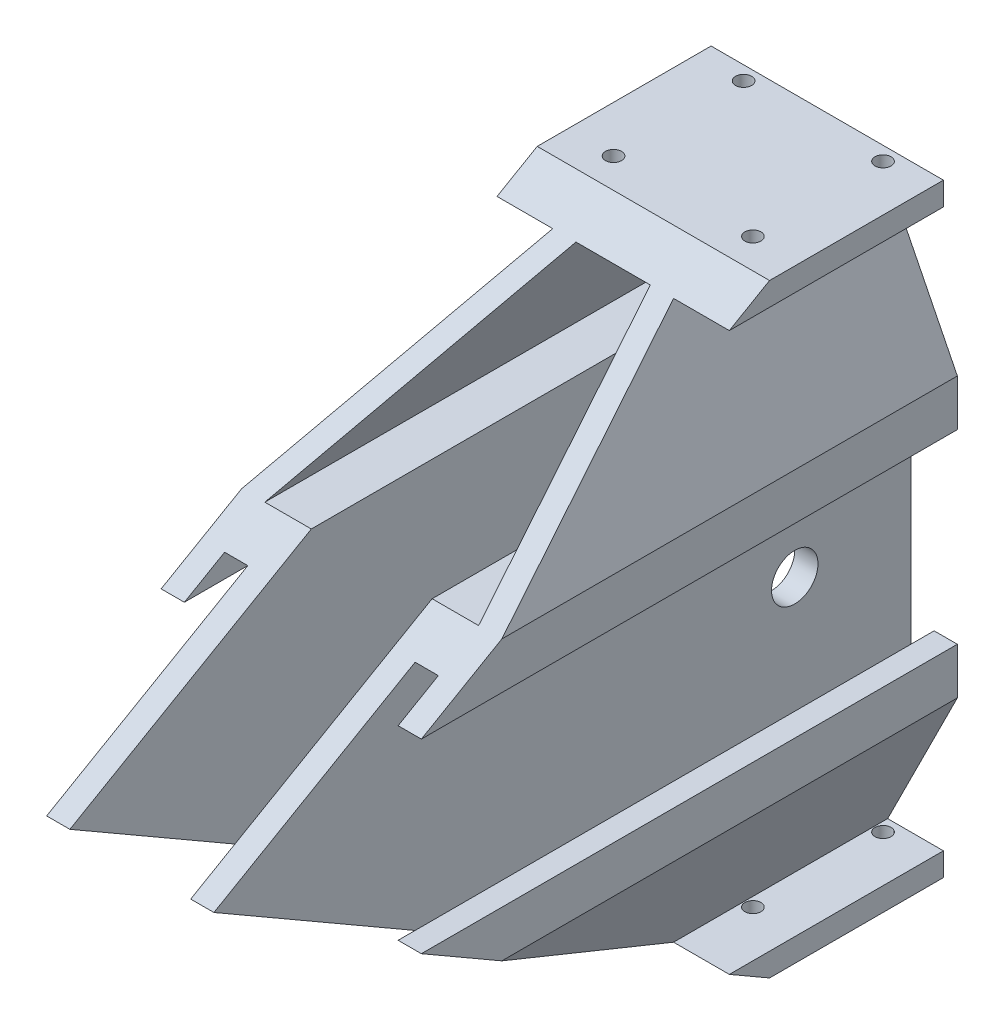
SolidWorks part; units mm, degrees
ref_plane "Front Plane" through (0, 0, 0) normal (0, 0, 1) x (1, 0, 0)
ref_plane "Top Plane" through (0, 0, 0) normal (0, 1, 0) x (1, 0, 0)
ref_plane "Right Plane" through (0, 0, 0) normal (1, 0, 0) x (0, 0, -1)
sketch "Sketch1" plane through (0, 0, 0) normal (0, 0, 1) x (1, 0, 0)
  line L0 (-18, 25) -> (-23, 25)
  line L1 (-18, 0) -> (18, 0) construction
  line L2 (-18, 25) -> (-18, -25)
  line L3 (-18, 25) -> (18, 25) construction
  line L4 (18, 25) -> (18, -25)
  line L5 (-18, 0) -> (18, 25) construction
  line L6 (-18, 25) -> (18, 0) construction
  line L7 (-23, 25) -> (-23, 20)
  line L8 (-23, 20) -> (-28, 20)
  line L9 (-28, 20) -> (-28, 30)
  line L10 (-28, 30) -> (-13, 60)
  line L11 (-13, 60) -> (-25, 60)
  line L12 (-25, 60) -> (-25, 65)
  line L13 (-25, 65) -> (25, 65)
  line L14 (25, 65) -> (25, 60)
  line L15 (25, 60) -> (13, 60)
  line L16 (18, 25) -> (23, 25)
  line L17 (23, 25) -> (23, 20)
  line L18 (23, 20) -> (28, 20)
  line L19 (28, 20) -> (28, 30)
  line L20 (28, 30) -> (13, 60)
  line L21 (-18, -25) -> (18, 0) construction
  line L22 (-18, 0) -> (18, -25) construction
  line L23 (-13, 30) -> (-13, -30)
  line L24 (-13, 30) -> (-23, 30)
  line L25 (13, -30) -> (13, 30)
  line L26 (13, 30) -> (23, 30)
  line L27 (23, 30) -> (8, 60)
  line L28 (-23, 30) -> (-8, 60)
  line L29 (-8, 60) -> (0, 60)
  line L30 (8, 60) -> (0, 60)
  line L31 (-18, -25) -> (18, -25) construction
  line L32 (8, -60) -> (0, -60)
  line L33 (-8, -60) -> (0, -60)
  line L34 (-23, -30) -> (-8, -60)
  line L35 (23, -30) -> (8, -60)
  line L36 (13, -30) -> (23, -30)
  line L37 (-13, -30) -> (-23, -30)
  line L38 (28, -30) -> (13, -60)
  line L39 (28, -20) -> (28, -30)
  line L40 (23, -20) -> (28, -20)
  line L41 (23, -25) -> (23, -20)
  line L42 (18, -25) -> (23, -25)
  line L43 (25, -60) -> (13, -60)
  line L44 (25, -65) -> (25, -60)
  line L45 (-25, -65) -> (25, -65)
  line L46 (-25, -60) -> (-25, -65)
  line L47 (-13, -60) -> (-25, -60)
  line L48 (-28, -30) -> (-13, -60)
  line L49 (-28, -20) -> (-28, -30)
  line L50 (-23, -20) -> (-28, -20)
  line L51 (-23, -25) -> (-23, -20)
  line L52 (-18, -25) -> (-23, -25)
  point P0 (0, 12.5)
  point P19 (0, 65)
  point P38 (13, 0)
  point P39 (-13, 0)
  point P53 (0, -65)
  point P54 (0, -12.5)
  dimension "D2" = 25
  dimension "D3" = 5
  dimension "D4" = 5
  dimension "D5" = 10
  dimension "D6" = 12
  dimension "D7" = 5
  dimension "D8" = 15
  dimension "D9" = 5
  dimension "D10" = 30
  dimension "D11" = 5
  dimension "D12" = 5
  dimension "D13" = 5
  dimension "D14" = 26
  dimension "D15" = 5
extrude "main" add sketch "Sketch1" against normal blind 150
sketch "Sketch2" plane through (0, 0, 0) normal (1, 0, 0) x (0, 0, -1)
  line L1 (150, -25) -> (150, 25) construction
  circle A0 centre (125, 0) radius 5
  dimension "D1" = 10
  dimension "D2" = 25
extrude "stock mount hole" cut sketch "Sketch2" against normal through all and the other way through all
sketch "Sketch3" plane through (0, 0, 0) normal (1, 0, 0) x (0, 0, -1)
  line L0 (0, 0) -> (112.5833, 65)
  line L2 (112.5833, 65) -> (0, 65)
  line L3 (0, 65) -> (0, 0)
  dimension "D2" = 30
extrude "top angled cut" cut sketch "Sketch3" against normal through all and the other way through all
mirror "bottom angled cut" about plane through (0, 0, 0) normal (0, 1, 0) of "top angled cut"
hole_wizard "#8-32 Tapped Hole1" positions "Sketch6" profile "Sketch5" tap size "#8-32" standard "Ansi Inch"
sketch "Sketch6" plane through (0, 65, 0) normal (0, 1, 0) x (-1, 0, 0)
  line L0 (25, -150) -> (25, -112.5833) construction
  line L3 (-25, -150) -> (25, -150) construction
  point P0 (15, -147)
  point P1 (-15, -147)
  point P3 (15, -119)
  point P5 (-15, -119)
  dimension "D1" = 10
  dimension "D2" = 3
  dimension "D3" = 30
  dimension "D4" = 28
sketch "Sketch5" plane through (-15, 65, -147) normal (1, 0, 0) x (0, 0, 1)
  line L0 (0, 0) -> (0, 6.0378)
  line L1 (0, 6.0378) -> (1.7272, 5)
  line L2 (1.7272, 5) -> (1.7272, 0)
  line L5 (1.7272, 0) -> (0, 0)
  line L10 (0, 6.0378) -> (-1.7272, 5) construction
  line L11 (0, -6.35) -> (0, 107.95) construction
  dimension "Tap Drill Dia." = 3.4544
  dimension "Tap Drill Depth" = 5
  dimension "Drill Angle" = 118
mirror "tapped hole bottom" about plane through (0, 0, 0) normal (0, 1, 0) of "#8-32 Tapped Hole1"
